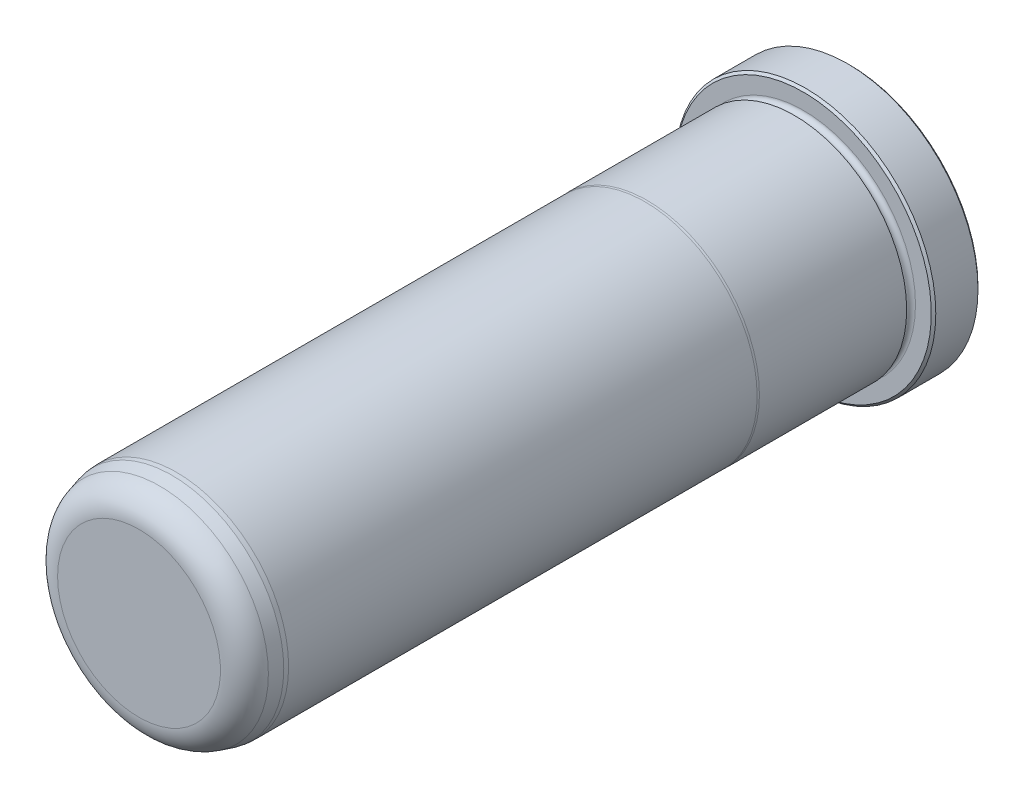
SolidWorks part; units mm, degrees
ref_plane "Front Plane" through (0, 0, 0) normal (0, 0, 1) x (1, 0, 0)
ref_plane "Top Plane" through (0, 0, 0) normal (0, 1, 0) x (1, 0, 0)
ref_plane "Right Plane" through (0, 0, 0) normal (1, 0, 0) x (0, 0, -1)
sketch "Sketch1" plane through (0, 0, 0) normal (1, 0, 0) x (0, 0, -1)
  line L0 (0, 0) -> (0, 22.098)
  line L1 (0, 22.098) -> (-7.9248, 22.098)
  line L2 (-7.9248, 22.098) -> (-7.9248, 19.0373)
  line L3 (-7.9248, 18.2753) -> (-9.4488, 18.2753) construction
  line L4 (-9.4488, 19.0373) -> (-9.4488, 19.0627)
  line L5 (-9.4488, 19.0627) -> (-34.4348, 19.0627)
  line L6 (-34.4348, 19.0627) -> (-34.798, 19.0373)
  line L7 (-34.798, 19.0373) -> (-114.3, 19.0373)
  line L9 (-120.65, 17.4733) -> (-120.65, 0)
  line L10 (-120.65, 0) -> (0, 0)
  line L11 (0, 0) -> (13.6287, 0) construction
  line L12 (-114.3, 19.0373) -> (-115.062, 18.9706)
  line L13 (-115.062, 18.9706) -> (-120.65, 17.4733)
  arc A0 (-9.4488, 19.0373) -> (-7.9248, 19.0373) centre (-8.6868, 19.0373) ccw
  dimension "D14" = 1.524
  dimension "D1" = 7.9248
  dimension "D2" = 1.524
  dimension "D3" = 44.196
  dimension "D4" = 38.1254
  dimension "D5" = 34.798
  dimension "D6" = 120.65
  dimension "D7" = 0.7874
  dimension "D8" = 4
  dimension "D9" = 38.0746
  dimension "D10" = 5
  dimension "D11" = 15
  dimension "D12" = 0.762
  dimension "D13" = 6.35
revolve "Revolve1" add sketch "Sketch1" angle 360 about L11
fillet "Fillet6" radius 4.7625 1 edges at (17.4733, 0, 120.65)
chamfer "Chamfer1" distance 0.381 angle 45 2 edges at (22.098, 0, 0) (22.098, 0, 7.9248)
